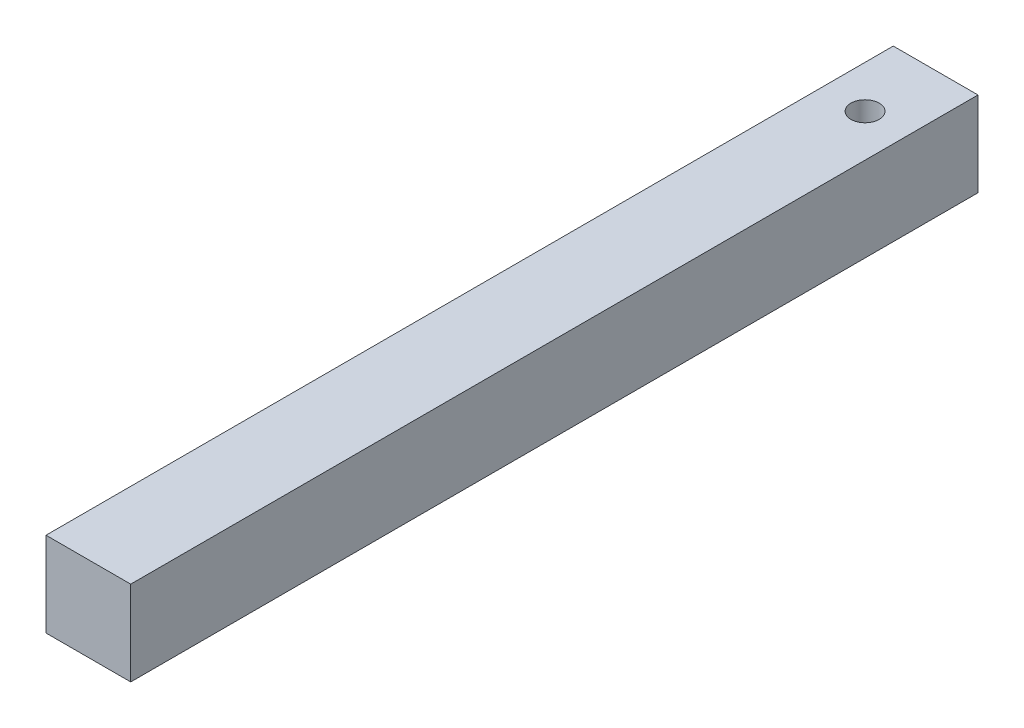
SolidWorks part; units mm, degrees
other "Leg"
ref_plane "Front Plane" through (0, 0, 0) normal (0, 0, 1) x (1, 0, 0)
ref_plane "Top Plane" through (0, 0, 0) normal (0, 1, 0) x (1, 0, 0)
ref_plane "Right Plane" through (0, 0, 0) normal (1, 0, 0) x (0, 0, -1)
sketch "Sketch1" plane through (0, 0, 0) normal (0, 1, 0) x (1, 0, 0)
  line L13 (-9.525, 95.25) -> (9.525, 95.25)
  line L14 (-9.525, 95.25) -> (-9.525, -95.25)
  line L15 (-9.525, -95.25) -> (9.525, -95.25)
  line L16 (9.525, 95.25) -> (9.525, -95.25)
  line L17 (-9.525, 95.25) -> (9.525, -95.25) construction
  line L18 (-9.525, -95.25) -> (9.525, 95.25) construction
  point P0 (0, 0)
  dimension "D1" = 19.05
  dimension "D2" = 190.5
extrude "Profile" add sketch "Sketch1" along normal blind 19.05
sketch "Sketch2" plane through (0, 19.05, 0) normal (0, 1, 0) x (1, 0, 0)
  line L0 (9.525, 95.25) -> (-9.525, 84.2515)
  line L1 (9.525, 95.25) -> (-9.525, 95.25) construction
  line L3 (-9.525, 95.25) -> (-9.525, -95.25) construction
  dimension "D1" = 30
extrude "30deg Top Cut" [suppressed] cut sketch "Sketch2" against normal blind 25.654 and the other way through all contours L0 M3 M4
sketch "Sketch3" [suppressed] plane through (-39.5506, 0, -68.5037) normal (-0.5, 0, -0.866) x (-0.866, 0, 0.5)
  line L0 (-34.6706, 9.525) -> (-56.6676, 9.525) construction
  line L1 (-34.6706, 19.05) -> (-34.6706, 0) construction
  line L2 (-56.6676, 19.05) -> (-56.6676, 0) construction
  point P6 (-45.6691, 9.525)
sketch "Sketch4" plane through (0, 19.05, 0) normal (0, 1, 0) x (1, 0, 0)
  line L0 (9.525, -95.25) -> (-9.525, -84.2515)
  line L3 (-9.525, 95.25) -> (-9.525, -95.25) construction
  line L4 (-9.525, -95.25) -> (9.525, -95.25) construction
  point P7 (0, 0)
  dimension "D1" = 30
extrude "30deg Bottom Cut" [suppressed] cut sketch "Sketch4" against normal blind 44.704 and the other way through all
sketch "Sketch8" [suppressed] plane through (0, 19.05, 0) normal (0, 1, 0) x (1, 0, 0)
  line L0 (0, 91.3382) -> (0, 75.4632) construction
  circle A0 centre (0, 75.4632) radius 1.5
  dimension "D1" = 3
  dimension "D2" = 15.875
extrude "Adapter Hole" [suppressed] cut sketch "Sketch8" against normal blind 30.988
sketch "Sketch9" plane through (0, 0, -95.25) normal (0, 0, -1) x (-1, 0, 0)
  line L0 (0, 0) -> (0, 19.05) construction
  line L1 (-9.525, 19.05) -> (9.525, 19.05) construction
  point P5 (0, 9.525)
sketch "Sketch10" plane through (0, 19.05, 0) normal (0, 1, 0) x (1, 0, 0)
  line L0 (0, 95.25) -> (0, 79.375) construction
  circle A0 centre (0, 79.375) radius 3.175
  dimension "D1" = 6.35
  dimension "D2" = 15.875
extrude "Cut-Extrude1" cut sketch "Sketch10" against normal blind 41.148
